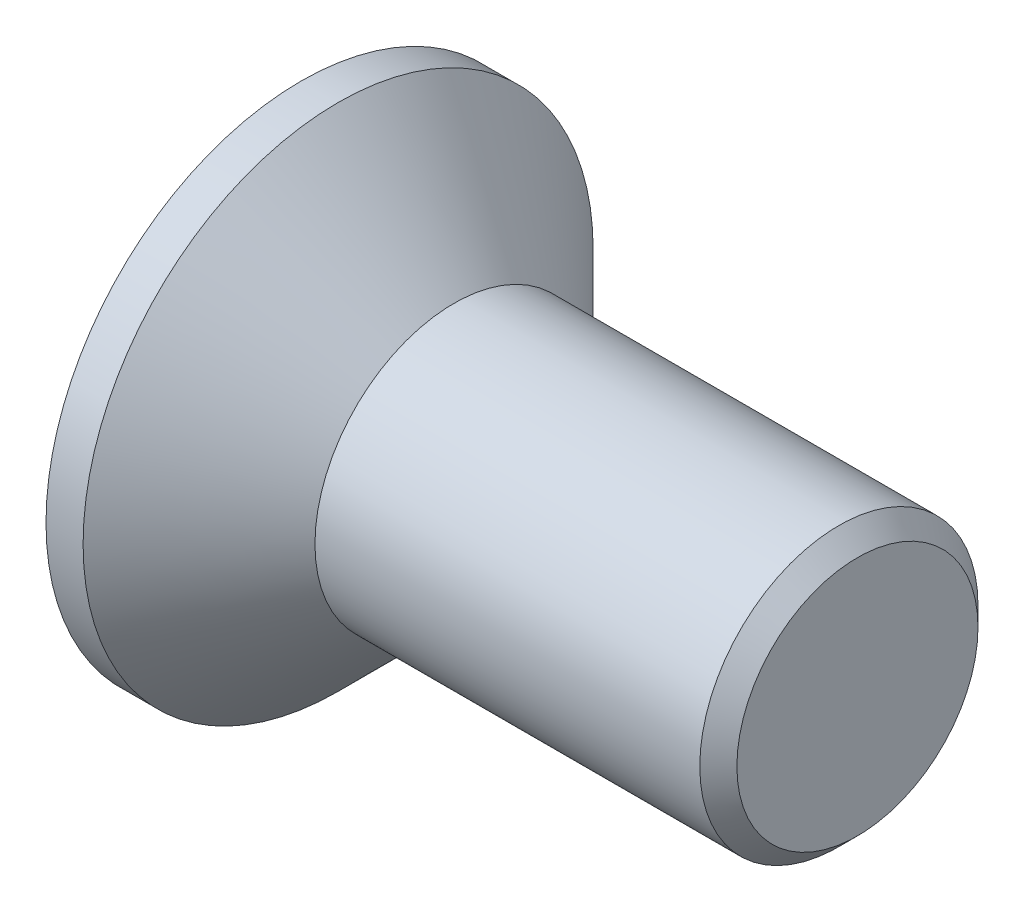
SolidWorks part; units mm, degrees
ref_plane "Vorne" through (0, 0, 0) normal (0, 0, 1) x (1, 0, 0)
ref_plane "Oben" through (0, 0, 0) normal (0, 1, 0) x (1, 0, 0)
ref_plane "Rechts" through (0, 0, 0) normal (1, 0, 0) x (0, 0, -1)
other "PropertyManager"
sketch "Skizze1" plane through (0, 0, 0) normal (0, 0, 1) x (1, 0, 0)
  line L0 (0, 0) -> (6.0293, 0) construction
  line L1 (0, 1.4) -> (0, 2.75)
  line L2 (0, 2.75) -> (0.4, 2.75)
  line L3 (0.4, 2.75) -> (1.65, 1.5)
  line L6 (1.65, 1.5) -> (5.8, 1.5)
  line L7 (6, 1.3) -> (6, 0)
  line L8 (5.8, 1.5) -> (6, 1.3)
  line L9 (0, 1.4) -> (0.3751, 0)
  line L10 (6, 0) -> (0.3751, 0)
  point P7 (1.75, 1.25)
  point P8 (6, 1.5)
  dimension "Kopfhoehe" = 1.65
  dimension "D2" = 45
  dimension "Kopfdurchmesser" = 5.5
  dimension "Laenge" = 6
  dimension "Nenngewinde" = 3
  dimension "D10" = 0.2
  dimension "D8" = 75
  dimension "Schluesselweite" = 2.8
revolve "Rotation1" add sketch "Skizze1" angle 360 about L0
sketch "Skizze2" plane through (0, 0, 0) normal (-1, 0, 0) x (0, 0, 1)
  line L0 (0, 1.4) -> (0, -1.4) construction
  line L1 (-1.4, 0) -> (1.4, 0) construction
  line L2 (-0.7, 1.2124) -> (0.7, -1.2124) construction
  line L3 (-1.2124, 0.7) -> (1.2124, -0.7) construction
  line L4 (-0.7, -1.2124) -> (0.7, 1.2124) construction
  line L5 (-1.2124, -0.7) -> (1.2124, 0.7) construction
  circle A0 centre (0, 0) radius 1.4 construction
  arc A1 (0.2724, 1.1846) -> (-0.2724, 1.1846) centre (0, 1.12) ccw
  arc A2 (1.1621, 0.3564) -> (0.8897, 0.8282) centre (0.9699, 0.56) ccw
  arc A3 (0.8897, -0.8282) -> (1.1621, -0.3564) centre (0.9699, -0.56) ccw
  arc A4 (-0.2724, -1.1846) -> (0.2724, -1.1846) centre (0, -1.12) ccw
  arc A5 (-1.1621, -0.3564) -> (-0.8897, -0.8282) centre (-0.9699, -0.56) ccw
  arc A6 (-0.8897, 0.8282) -> (-1.1621, 0.3564) centre (-0.9699, 0.56) ccw
  arc A7 (-0.8897, 0.8282) -> (-0.2724, 1.1846) centre (-0.7492, 1.2977) ccw
  arc A8 (0.2724, 1.1846) -> (0.8897, 0.8282) centre (0.7492, 1.2977) ccw
  arc A9 (1.1621, 0.3564) -> (1.1621, -0.3564) centre (1.4984, 0) ccw
  arc A10 (0.8897, -0.8282) -> (0.2724, -1.1846) centre (0.7492, -1.2977) ccw
  arc A11 (-0.2724, -1.1846) -> (-0.8897, -0.8282) centre (-0.7492, -1.2977) ccw
  arc A12 (-1.1621, -0.3564) -> (-1.1621, 0.3564) centre (-1.4984, 0) ccw
  dimension "D-Klein" = 0.56
  dimension "D-Gross" = 0.98
  dimension "D1" = 30
  dimension "D2" = 30
  dimension "D3" = 30
  dimension "D4" = 30
extrude "Schnitt-Linear austragen1" cut sketch "Skizze2" against normal blind 0.83
